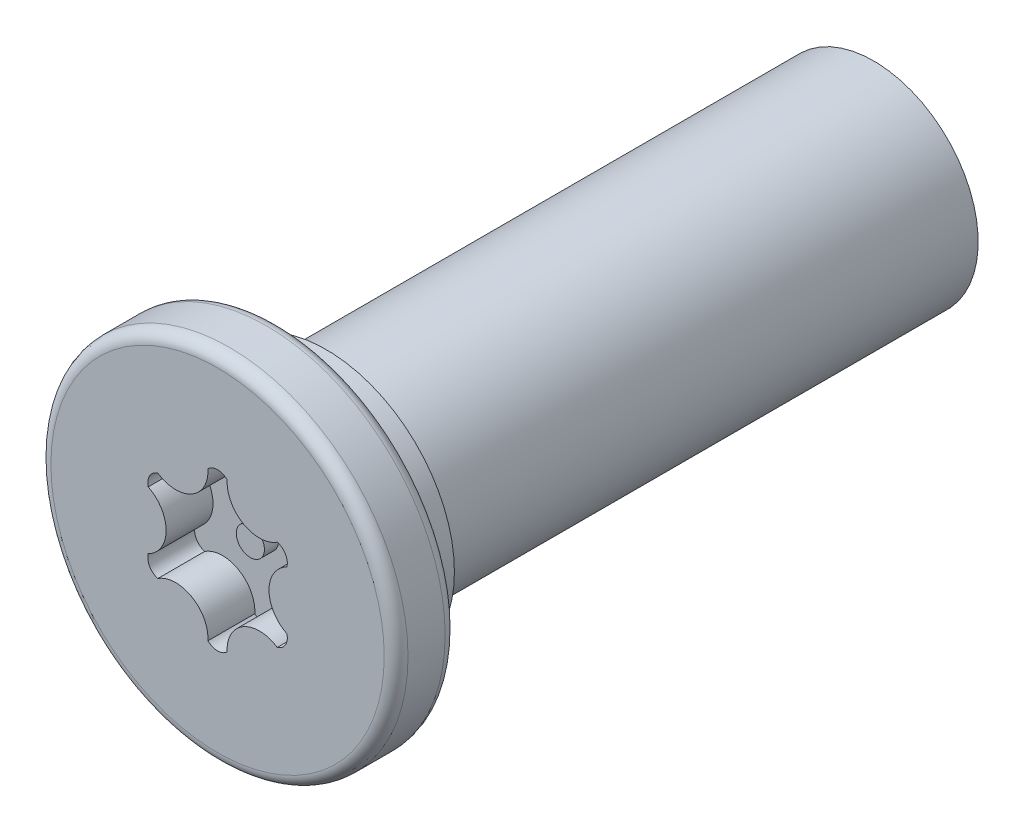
SolidWorks part; units mm, degrees
ref_plane "Front Plane" through (0, 0, 0) normal (0, 0, 1) x (1, 0, 0)
ref_plane "Top Plane" through (0, 0, 0) normal (0, 1, 0) x (1, 0, 0)
ref_plane "Right Plane" through (0, 0, 0) normal (1, 0, 0) x (0, 0, -1)
sketch "Sketch2" plane through (0, 0, 0) normal (1, 0, 0) x (0, 0, -1)
  line L1 (0, 0) -> (1.3, 0)
  line L2 (0, 0) -> (0, 3.81)
  line L3 (0, 3.81) -> (1.3, 3.81)
  line L4 (1.3, 0) -> (1.3, 3.81)
  line L5 (1.3, 0) -> (14, 0)
  line L6 (1.3, 0) -> (1.3, 2.23)
  line L7 (1.3, 2.23) -> (14, 2.23)
  line L8 (14, 0) -> (14, 2.23)
  dimension "D1" = 3.81
  dimension "D2" = 1.3
  dimension "D3" = 12.7
  dimension "D4" = 2.23
revolve "Revolve1" add sketch "Sketch2" angle 360 about L5
sketch "Sketch3" plane through (0, 0, 0) normal (0, 0, 1) x (1, 0, 0)
  line L0 (0, 1.3843) -> (0, 0)
  line L3 (1.1845, -1.0048) -> (2.4257, -1.0048)
  line L4 (0, 1.675) -> (0, 1.6727)
  line L5 (0, 1.675) -> (0, 1.6727)
  line L6 (0, 1.6727) -> (0, 1.675)
  line L8 (1.0407, 1.8026) -> (1.1012, 1.9073)
  line L9 (1.3857, 1.205) -> (2.5818, 1.205)
  line L10 (0, 0) -> (0.8375, 1.4506)
  line L11 (0, 0) -> (2.5818, 0)
  line L14 (2.5818, 0) -> (2.5818, 1.205)
  line L15 (1.3857, 1.205) -> (-0.1691, 1.205)
  circle A0 centre (0, 0) radius 1.675
  arc A7 (1.1845, -1.0048) -> (1.0345, -1.0748) centre (0.8546, -0.4934) cw
  arc A16 (-0.2051, 1.5894) -> (0.2051, 1.5894) centre (0, 1.3843) cw
  arc A18 (0.2051, 1.5894) -> (1.2739, 0.9723) centre (0.8938, 1.5482) ccw
  arc A19 (1.479, 0.6171) -> (1.479, -0.6171) centre (1.7877, 0) ccw
  arc A20 (1.2739, 0.9723) -> (1.479, 0.6171) centre (1.1988, 0.6922) cw
  arc A21 (1.2739, -0.9723) -> (0.2051, -1.5894) centre (0.8938, -1.5482) ccw
  arc A22 (1.479, -0.6171) -> (1.2739, -0.9723) centre (1.1988, -0.6922) cw
  arc A23 (-0.2051, -1.5894) -> (-1.2739, -0.9723) centre (-0.8938, -1.5482) ccw
  arc A24 (0.2051, -1.5894) -> (-0.2051, -1.5894) centre (0, -1.3843) cw
  arc A25 (-1.479, -0.6171) -> (-1.479, 0.6171) centre (-1.7877, 0) ccw
  arc A26 (-1.2739, -0.9723) -> (-1.479, -0.6171) centre (-1.1988, -0.6922) cw
  arc A27 (-1.2739, 0.9723) -> (-0.2051, 1.5894) centre (-0.8938, 1.5482) ccw
  arc A28 (-1.479, 0.6171) -> (-1.2739, 0.9723) centre (-1.1988, 0.6922) cw
  point P38 (0, 0)
  point P52 (0, 0)
  dimension "D1" = 3.35
  dimension "D4" = 1.205
  dimension "D2" = 6
  dimension "D5" = 60
extrude "Cut-Extrude3" cut sketch "Sketch3" against normal blind 1
fillet "Fillet12" radius 0.254 2 edges at (3.81, 0, 0) (3.81, 0, -1.3)
sketch "Sketch7" plane through (0, 0, -14) normal (0, 0, -1) x (-1, 0, 0)
  circle A0 centre (0, 0) radius 2.23
  dimension "D1" = 4.46
extrude "Cut-Extrude6" cut sketch "Sketch7" against normal blind 12.7
sketch "Sketch11" plane through (0, 0, -1.3) normal (0, 0, -1) x (-1, 0, 0)
  circle A0 centre (0, 0) radius 2.23
  circle A1 centre (0, 0) radius 2.738
extrude "Boss-Extrude1" add sketch "Sketch11" along normal blind 1.016
sketch "Sketch12" plane through (0, 0, -1.3) normal (0, 0, -1) x (-1, 0, 0)
  circle A0 centre (0, 0) radius 2.23
extrude "Boss-Extrude2" add sketch "Sketch12" along normal blind 12.7
sketch "Sketch14" plane through (0, 0, -1) normal (0, 0, 1) x (1, 0, 0)
  circle A0 centre (0, 0) radius 0.3
extrude "Boss-Extrude4" add sketch "Sketch14" along normal blind 0.3
sketch "Sketch15" plane through (0, 0, -14) normal (0, 0, -1) x (-1, 0, 0)
  circle A0 centre (0, 0) radius 2.23
extrude "Cut-Extrude7" cut sketch "Sketch15" against normal blind 12.7
sketch "Sketch16" plane through (0, 0, -1.3) normal (0, 0, -1) x (-1, 0, 0)
  circle A0 centre (0, 0) radius 2.23
extrude "Boss-Extrude5" add sketch "Sketch16" along normal blind 12.7
